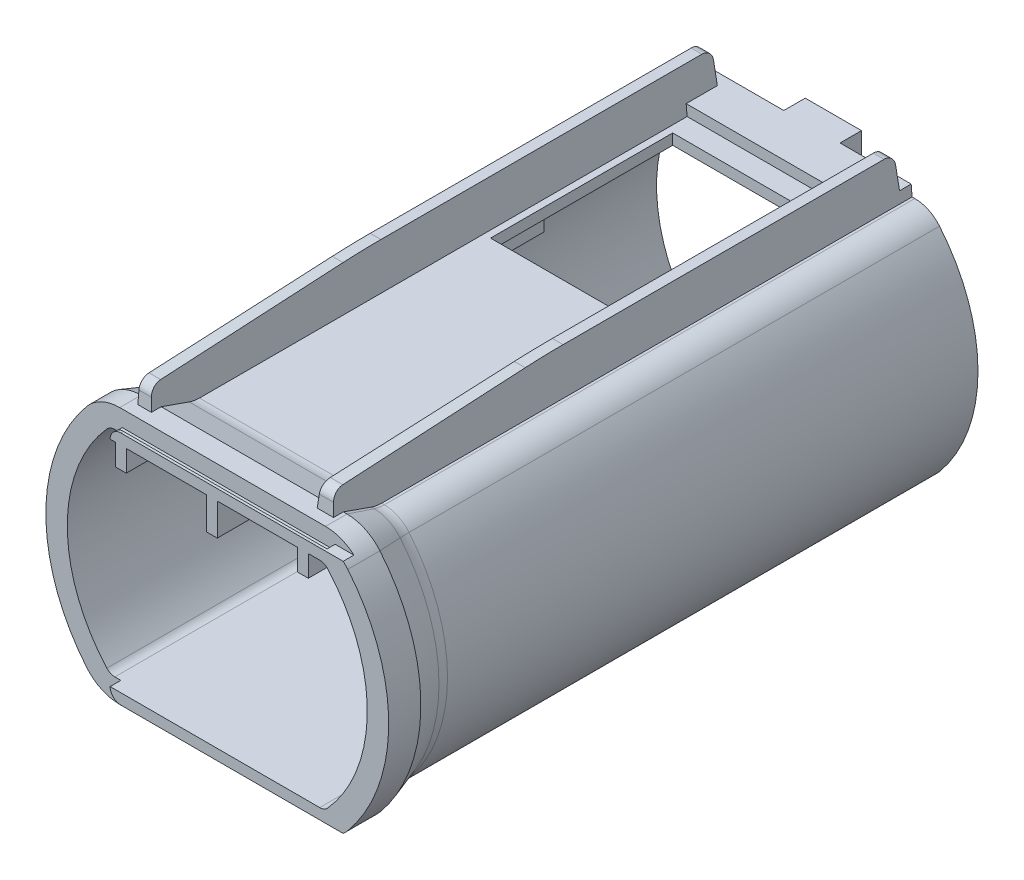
SolidWorks part; units mm, degrees
ref_plane "Front Plane" through (0, 0, 0) normal (0, 0, 1) x (1, 0, 0)
ref_plane "Top Plane" through (0, 0, 0) normal (0, 1, 0) x (1, 0, 0)
ref_plane "Right Plane" through (0, 0, 0) normal (1, 0, 0) x (0, 0, -1)
sketch "Sketch1" plane through (0, 0, 0) normal (0, 0, 1) x (1, 0, 0)
  line L0 (0, -10) -> (0, 10) construction
  line L1 (-10.5, 10) -> (10.5, 10)
  line L2 (14.5, 0) -> (14.5, 10) construction
  line L3 (-10.5, -10) -> (10.5, -10)
  line L4 (10.5, 10) -> (10.5, -10) construction
  line L5 (-14.5, 0) -> (-14.5, 15.1719) construction
  arc A0 (10.5, -10) -> (10.5, 10) centre (0, 0) ccw
  arc A1 (-10.5, 10) -> (-10.5, -10) centre (0, 0) ccw
  point P8 (0, 0)
  dimension "D1" = 29
  dimension "D2" = 20
extrude "Extrude-Thin2" add sketch "Sketch1" along normal blind 53 thin
fillet "Fillet3" radius 1 4 edges at (10.5, -10, 26.5) (-10.5, -10, 26.5) (-10.5, 10, 26.5) (10.5, 10, 26.5)
fillet "Fillet4" radius 3 4 edges at (10.9202, -11, 26.5) (10.9202, 11, 26.5) (-10.9202, -11, 26.5) (-10.9202, 11, 26.5)
ref_plane "Plane2" through (0, 0, 56) normal (0, 0, 1) x (1, 0, 0)
sketch "Sketch27" plane through (0, 0, 53) normal (0, 0, 1) x (1, 0, 0)
  circle A0 centre (0, 0) radius 21.9056
extrude "Extrude13" add sketch "Sketch27" along normal blind 2
chamfer "Chamfer1" distance 3 distance2 1 8 edges at (0, -11, 53) (10.8775, -10.7166, 53) (-10.8775, -10.7166, 53) (15.5, 0, 53) (-15.5, 0, 53) (10.8775, 10.7166, 53) (-10.8775, 10.7166, 53) (0, 11, 53)
ref_plane "Plane4" through (0, 0, 53) normal (0, 0, -1) x (-1, 0, 0)
other "SurfaceCut1"
fillet "Fillet6" radius 3 8 edges at (-10.8775, 10.7166, 50) (-10.8775, -10.7166, 50) (0, -11, 50) (10.8775, -10.7166, 50) (15.5, 0, 50) (10.8775, 10.7166, 50) (0, 11, 50) (-15.5, 0, 50)
sketch "Sketch8" plane through (0, 11, 0) normal (0, 1, 0) x (-1, 0, 0)
  line L1 (9, 0) -> (-9, 0)
  line L2 (9, 0) -> (9, 4)
  line L3 (9, 4) -> (-9, 4)
  line L4 (-9, 0) -> (-9, 4)
  line L5 (-9.6047, 0) -> (9.6047, 0) construction
  point P6 (0, 4)
  dimension "D1" = 18
  dimension "D2" = 4
extrude "Extrude7" add sketch "Sketch8" along normal blind 1
sketch "Sketch28" plane through (0, 0, 53) normal (0, 0, 1) x (1, 0, 0)
  line L0 (10.0623, 10) -> (-10.0623, 10) construction
  line L1 (-10.0623, -10) -> (10.0623, -10) construction
  line L2 (9.6047, 12) -> (-9.6047, 12)
  line L3 (9.6047, 12) -> (-9.6047, 12)
  line L4 (-9.6047, -12) -> (9.6047, -12)
  line L5 (-9.6047, -12) -> (9.6047, -12)
  line L6 (10.0623, 10) -> (-10.0623, 10)
  line L7 (-10.0623, -10) -> (10.0623, -10)
  arc A0 (10.0623, -10) -> (10.8077, -9.6667) centre (10.0623, -9) ccw construction
  arc A1 (10.8077, -9.6667) -> (10.8077, 9.6667) centre (0, 0) ccw construction
  arc A2 (10.8077, 9.6667) -> (10.0623, 10) centre (10.0623, 9) ccw construction
  arc A3 (-10.0623, 10) -> (-10.8077, 9.6667) centre (-10.0623, 9) ccw construction
  arc A4 (-10.8077, 9.6667) -> (-10.8077, -9.6667) centre (0, 0) ccw construction
  arc A5 (-10.8077, -9.6667) -> (-10.0623, -10) centre (-10.0623, -9) ccw construction
  arc A6 (10.0623, -10) -> (10.8077, -9.6667) centre (10.0623, -9) ccw
  arc A7 (10.8077, -9.6667) -> (10.8077, 9.6667) centre (0, 0) ccw
  arc A8 (12.6782, 10.56) -> (9.6047, 12) centre (9.6047, 8) ccw
  arc A9 (12.6782, 10.56) -> (9.6047, 12) centre (9.6047, 8) ccw
  arc A10 (-9.6047, 12) -> (-12.6782, 10.56) centre (-9.6047, 8) ccw
  arc A11 (-9.6047, 12) -> (-12.6782, 10.56) centre (-9.6047, 8) ccw
  arc A12 (-12.6782, -10.56) -> (-9.6047, -12) centre (-9.6047, -8) ccw
  arc A13 (-12.6782, -10.56) -> (-9.6047, -12) centre (-9.6047, -8) ccw
  arc A14 (-12.6782, 10.56) -> (-12.6782, -10.56) centre (0, 0) ccw
  arc A15 (-12.6782, 10.56) -> (-12.6782, -10.56) centre (0, 0) ccw
  arc A16 (9.6047, -12) -> (12.6782, -10.56) centre (9.6047, -8) ccw
  arc A17 (9.6047, -12) -> (12.6782, -10.56) centre (9.6047, -8) ccw
  arc A18 (12.6782, -10.56) -> (12.6782, 10.56) centre (0, 0) ccw
  arc A19 (12.6782, -10.56) -> (12.6782, 10.56) centre (0, 0) ccw
  arc A24 (10.8077, 9.6667) -> (10.0623, 10) centre (10.0623, 9) ccw
  arc A25 (-10.0623, 10) -> (-10.8077, 9.6667) centre (-10.0623, 9) ccw
  arc A26 (-10.8077, 9.6667) -> (-10.8077, -9.6667) centre (0, 0) ccw
  arc A27 (-10.8077, -9.6667) -> (-10.0623, -10) centre (-10.0623, -9) ccw
  dimension "D1" = 0
extrude "Extrude14" add sketch "Sketch28" along normal blind 3
sketch "Sketch9" plane through (9, 0, 0) normal (1, 0, 0) x (0, 0, -1)
  line L0 (-1, 11) -> (-1.35, 15)
  line L2 (-54, 11) -> (-53.7375, 14)
  line L3 (-53.7375, 14) -> (-35.7699, 14.9103)
  line L4 (-32.2279, 15) -> (-1.35, 15)
  line L5 (-54, 11) -> (-1, 11)
  line L6 (-1, 11) -> (-1, 22.6172) construction
  line L7 (-54, 11) -> (-54, 21.6834) construction
  arc A0 (-35.7699, 14.9103) -> (-32.2279, 15) centre (-32.2279, -55) cw
  point P15 (-34, 15)
  dimension "D8" = 70
  dimension "D1" = 5
  dimension "D2" = 5
  dimension "D3" = 4
  dimension "D7" = 3
extrude "Extrude8" add sketch "Sketch9" against normal blind 1
draft "Draft1" type of draft neutral plane draft angle 5 faces to draft 2 parameters "D1"=5
fillet "Fillet5" radius 1 2 edges at (8.5, 15, 1.35) (8.5, 14, 53.7375)
mirror "Mirror2" about plane through (0, 0, 0) normal (1, 0, 0) of "Fillet5", "Draft1", "Extrude8"
sketch "Sketch14" plane through (0, 0, 56) normal (0, 0, 1) x (1, 0, 0)
  line L12 (9.6047, 12) -> (-9.6047, 12) construction
  line L13 (-9.6047, -12) -> (9.6047, -12) construction
  line L16 (9.6047, 12) -> (-9.6047, 12)
  line L19 (-9.6047, -12) -> (9.6047, -12)
  line L20 (10.0623, 11) -> (-10.0623, 11)
  line L21 (12.2504, 11) -> (-8.5, 11)
  line L22 (-10.0623, 10) -> (-9.5, 10)
  line L23 (-10.0623, -11) -> (10.0623, -11)
  line L24 (-8.5, -11) -> (12.2504, -11)
  line L25 (10.0623, 10) -> (-10.0623, 10) construction
  line L26 (-10.0623, -10) -> (-9.5, -10)
  line L27 (-10.0623, -10) -> (10.0623, -10) construction
  line L28 (-9.5, -10) -> (-9.5, 10) construction
  arc A12 (-10.8077, -9.6667) -> (-10.0623, -10) centre (-10.0623, -9) ccw construction
  arc A13 (-10.8077, 9.6667) -> (-10.8077, -9.6667) centre (0, 0) ccw construction
  arc A14 (-10.0623, 10) -> (-10.8077, 9.6667) centre (-10.0623, 9) ccw construction
  arc A18 (12.6782, 10.56) -> (9.6047, 12) centre (9.6047, 8) ccw construction
  arc A19 (-9.6047, 12) -> (-12.6782, 10.56) centre (-9.6047, 8) ccw construction
  arc A20 (-12.6782, 10.56) -> (-12.6782, -10.56) centre (0, 0) ccw construction
  arc A21 (-12.6782, -10.56) -> (-9.6047, -12) centre (-9.6047, -8) ccw construction
  arc A22 (9.6047, -12) -> (12.6782, -10.56) centre (9.6047, -8) ccw construction
  arc A25 (-10.8077, -9.6667) -> (-10.0623, -10) centre (-10.0623, -9) ccw
  arc A26 (-10.8077, 9.6667) -> (-10.8077, -9.6667) centre (0, 0) ccw
  arc A27 (-10.0623, 10) -> (-10.8077, 9.6667) centre (-10.0623, 9) ccw
  arc A28 (12.2504, 11) -> (9.6047, 12) centre (9.6047, 8) ccw
  arc A29 (-9.6047, 12) -> (-12.6782, 10.56) centre (-9.6047, 8) ccw
  arc A30 (-12.6782, 10.56) -> (-12.6782, -10.56) centre (0, 0) ccw
  arc A31 (-12.6782, -10.56) -> (-9.6047, -12) centre (-9.6047, -8) ccw
  arc A32 (9.6047, -12) -> (12.2504, -11) centre (9.6047, -8) ccw
  arc A33 (-8.5, -11) -> (-9.5, -10) centre (-8.5, -10) cw
  arc A34 (-8.5, 11) -> (-9.5, 10) centre (-8.5, 10) ccw
  dimension "D3" = 7
  dimension "D1" = 1
  dimension "D2" = 1
extrude "Cut-Extrude3" cut sketch "Sketch14" against normal blind 1
sketch "Sketch15" plane through (0, -11, 0) normal (0, -1, 0) x (1, 0, 0)
  line L0 (-9.6047, 55) -> (9.6047, 55) construction
  line L1 (-9.5, 55) -> (10.5, 55)
  line L2 (-9.5, 55) -> (-9.5, 55.75)
  line L3 (-9.5, 55.75) -> (10.5, 55.75)
  line L4 (10.5, 55) -> (10.5, 55.75)
  line L8 (-9.5, 55) -> (-9.5, 56) construction
  dimension "D1" = 20
  dimension "D2" = 0.75
extrude "Cut-Extrude4" cut sketch "Sketch15" against normal blind 0.5
mirror "Mirror3" about plane through (0, 0, 0) normal (0, 1, 0) of "Cut-Extrude4"
sketch "Sketch16" plane through (0, 0, 56) normal (0, 0, 1) x (1, 0, 0)
  line L0 (8.5, 14.9103) -> (8.5, 4.0897) construction
  line L2 (-8.4961, 14.9103) -> (-8.4961, 3.833) construction
  line L7 (-8.4961, 10) -> (-8.4961, 8)
  line L9 (8.5, 8) -> (-8.4961, 8) construction
extrude "Extrude-Thin4" add sketch "Sketch16" against normal offset from surface (39 mm away) 17 thin
sketch "Sketch17" plane through (0, 0, 56) normal (0, 0, 1) x (1, 0, 0)
  line L0 (0, 0) -> (0, 10) construction
  line L2 (0, 10) -> (0, 7)
extrude "Extrude-Thin5" add sketch "Sketch17" against normal up to surface (39 mm away) thin
mirror "Mirror4" about plane through (0, 0, 0) normal (1, 0, 0) of "Extrude-Thin4"
sketch "Sketch18" plane through (0, 11, 0) normal (0, 1, 0) x (-1, 0, 0)
  line L0 (7.7375, 4) -> (-7.7375, 4) construction
  line L1 (-7.2461, 23) -> (6.9961, 23)
  line L4 (6.9961, 17) -> (6.9961, 56)
  line L5 (6.9961, 6) -> (6.9961, 23)
  line L6 (6.9961, 6) -> (-7.2461, 6)
  line L7 (-7.2461, 17) -> (-7.2461, 56)
  line L8 (-7.2461, 6) -> (-7.2461, 23)
  dimension "D3" = 19
  dimension "D4" = 17
  dimension "D1" = 1
  dimension "D2" = 0.75
extrude "Cut-Extrude5" cut sketch "Sketch18" against normal up to surface (4 mm away)
sketch "Sketch20" plane through (0, 0, 0) normal (0, 0, -1) x (-1, 0, 0)
  line L3 (2.625, 12) -> (2.625, 10)
  line L4 (2.625, 10) -> (-2.625, 10)
  line L5 (-2.625, 12) -> (-2.625, 10)
  line L6 (0, 0) -> (0, 10) construction
  line L7 (-2.625, 12) -> (2.625, 12)
  line L8 (-9.2625, 12) -> (9, 12) construction
  line L9 (-10.0623, 10) -> (10.0623, 10) construction
  dimension "D1" = 5.25
extrude "Extrude9" add sketch "Sketch20" along normal blind 2
ref_plane "Plane3" through (-5.5, 0, 0) normal (1, 0, 0) x (0, 0, -1)
sketch "Sketch21" plane through (-5.5, 0, 0) normal (1, 0, 0) x (0, 0, -1)
  line L0 (-13, -11) -> (-13.1187, -13.2658)
  line L1 (-49.5132, -11) -> (0, -11) construction
  line L2 (-18.8813, -13.2658) -> (-19, -11)
  line L3 (-19, -11) -> (-13, -11)
  line L4 (-16, -13.1148) -> (-16, 4.3405) construction
  line L6 (0, -9.92) -> (0, 9.92) construction
  arc A0 (-13.1187, -13.2658) -> (-18.8813, -13.2658) centre (-16, -13.1148) cw
  dimension "D2" = 5
  dimension "D1" = 6
  dimension "D3" = 3
  dimension "D4" = 16
extrude "Extrude10" add sketch "Sketch21" along normal blind 1
sketch "Sketch22" plane through (-5.5, 0, 0) normal (-1, 0, 0) x (0, 0, 1)
  circle A0 centre (16, -13.1148) radius 1
  dimension "D1" = 2
extrude "Cut-Extrude6" cut sketch "Sketch22" against normal through all
mirror "Mirror5" about plane through (0, 0, 0) normal (1, 0, 0) of "Cut-Extrude6", "Extrude10"
sketch "Sketch24" plane through (-4.5, 0, 0) normal (1, 0, 0) x (0, 0, -1)
  line L0 (-13.1187, -13.2658) -> (-13, -11) construction
  line L1 (-13, -11) -> (-19, -11) construction
  line L2 (-13.1187, -13.2658) -> (-13, -11)
  line L3 (-13, -11) -> (-13.7375, -11)
  line L4 (-13.1187, -13.2658) -> (-13.6187, -13.2658)
  line L5 (-13.6187, -13.2658) -> (-13.7375, -11)
  line L6 (-13.3687, -13.2658) -> (-13.3687, -8.7697) construction
  dimension "D1" = 0.5
extrude "Extrude11" add sketch "Sketch24" along normal blind 4.5
sketch "Sketch26" plane through (-4.5, 0, 5.2625) normal (1, 0, 0) x (0, 0, -1)
  line L0 (-13.7375, -11) -> (-13.6187, -13.2658) construction
  line L2 (-13.1187, -13.2658) -> (-13, -11)
  line L3 (-13, -11) -> (-13.7375, -11)
  line L4 (-13.1187, -13.2658) -> (-13.6187, -13.2658)
  line L5 (-13.6187, -13.2658) -> (-13.7375, -11)
  line L6 (-13.3687, -13.2658) -> (-13.3687, -8.7697) construction
extrude "Extrude12" add sketch "Sketch26" along normal up to surface (9 mm away)
